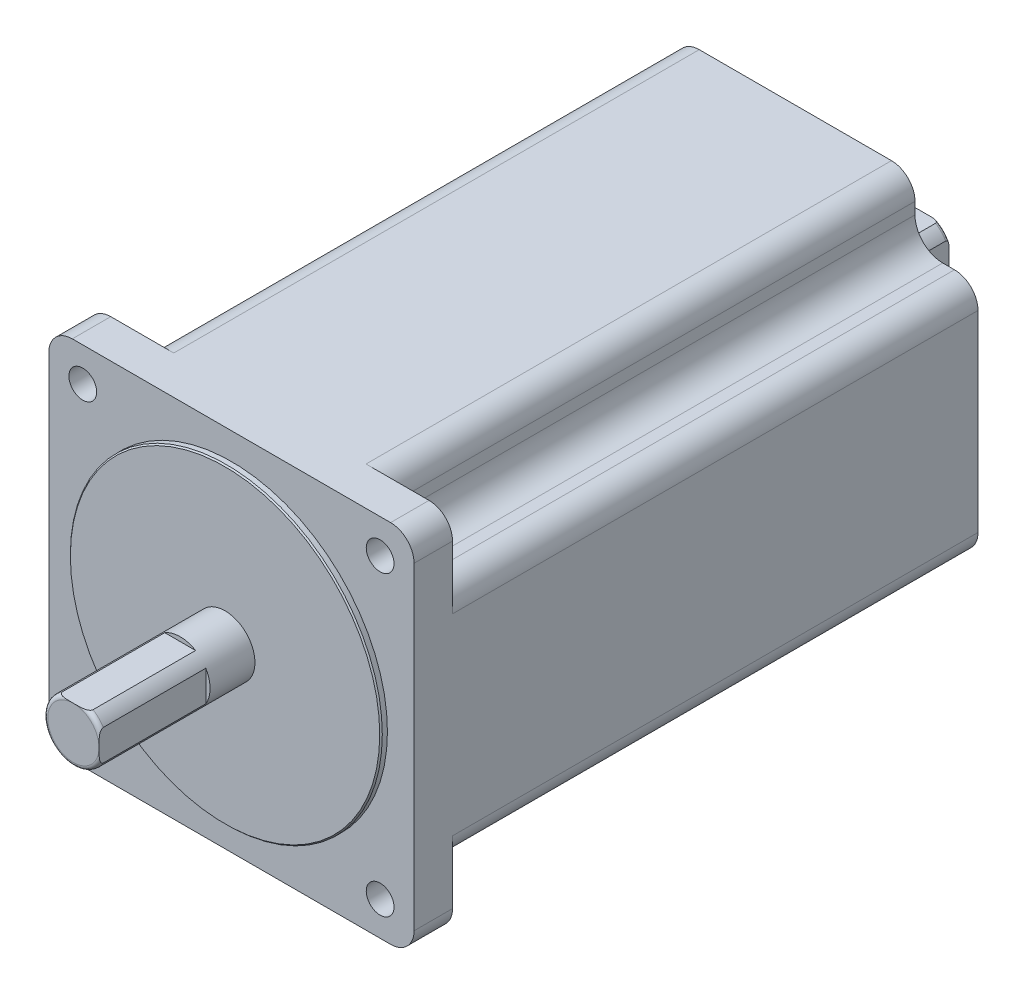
SolidWorks part; units mm, degrees
ref_plane "正面" through (0, 0, 0) normal (0, 0, 1) x (1, 0, 0)
ref_plane "平面" through (0, 0, 0) normal (0, 1, 0) x (1, 0, 0)
ref_plane "右側面" through (0, 0, 0) normal (1, 0, 0) x (0, 0, -1)
sketch "ｽｹｯﾁ1" plane through (0, 0, 0) normal (0, 0, 1) x (1, 0, 0)
  circle A0 centre (0, 0) radius 7
  dimension "D1" = 14
extrude "押し出し1" add sketch "ｽｹｯﾁ1" along normal blind 35.5
sketch "ｽｹｯﾁ2" plane through (0, 0, 0) normal (0, 0, -1) x (-1, 0, 0)
  circle A0 centre (0, 0) radius 36.5125
  dimension "D1" = 73.025
extrude "押し出し2" add sketch "ｽｹｯﾁ2" along normal blind 1.5
sketch "ｽｹｯﾁ3" plane through (0, 0, -1.5) normal (0, 0, -1) x (-1, 0, 0)
  line L1 (-42.75, 42.75) -> (42.75, 42.75)
  line L2 (-42.75, 42.75) -> (-42.75, -42.75)
  line L3 (-42.75, -42.75) -> (42.75, -42.75)
  line L4 (42.75, 42.75) -> (42.75, -42.75)
  line L5 (-42.75, 42.75) -> (42.75, -42.75) construction
  line L6 (-42.75, -42.75) -> (42.75, 42.75) construction
  line L7 (34.8, 34.8) -> (-34.8, 34.8) construction
  line L8 (34.8, 34.8) -> (34.8, -34.8) construction
  line L9 (34.8, -34.8) -> (-34.8, -34.8) construction
  line L10 (-34.8, 34.8) -> (-34.8, -34.8) construction
  line L11 (34.8, 34.8) -> (-34.8, -34.8) construction
  line L12 (34.8, -34.8) -> (-34.8, 34.8) construction
  circle A0 centre (34.8, 34.8) radius 3.25
  circle A1 centre (-34.8, 34.8) radius 3.25
  circle A2 centre (34.8, -34.8) radius 3.25
  circle A3 centre (-34.8, -34.8) radius 3.25
  point P0 (0, 0)
  point P6 (0, 0)
  dimension "D3" = 69.6
  dimension "D4" = 69.6
  dimension "D6" = 6.5
  dimension "D1" = 85.5
  dimension "D2" = 85.5
extrude "押し出し3" add sketch "ｽｹｯﾁ3" along normal blind 9
fillet "Fillet1" radius 5.5 4 edges at (42.75, -42.75, -6) (-42.75, -42.75, -6) (-42.75, 42.75, -6) (42.75, 42.75, -6)
sketch "ｽｹｯﾁ4" plane through (0, 0, -10.5) normal (0, 0, -1) x (-1, 0, 0)
  line L0 (28, 28) -> (42.75, 28)
  line L1 (-28, 42.75) -> (28, 42.75)
  line L2 (-28, 42.75) -> (-28, 28)
  line L3 (-28, -42.75) -> (28, -42.75)
  line L4 (28, 42.75) -> (28, 28)
  line L5 (-28, 42.75) -> (28, -42.75) construction
  line L6 (-28, -42.75) -> (28, 42.75) construction
  line L7 (-42.75, 28) -> (-28, 28)
  line L8 (-42.75, 28) -> (-42.75, -28)
  line L9 (-42.75, -28) -> (-28, -28)
  line L10 (42.75, 28) -> (42.75, -28)
  line L11 (-42.75, 28) -> (42.75, -28) construction
  line L12 (-42.75, -28) -> (42.75, 28) construction
  line L13 (-28, -28) -> (-28, -42.75)
  line L14 (28, -28) -> (42.75, -28)
  line L15 (28, -28) -> (28, -42.75)
  point P0 (0, 0)
  point P6 (0, 0)
  dimension "D1" = 56
  dimension "D2" = 85.5
  dimension "D3" = 85.5
  dimension "D4" = 56
extrude "押し出し4" add sketch "ｽｹｯﾁ4" along normal blind 123
fillet "Fillet2" radius 6.5 4 edges at (28, -28, -72) (-28, -28, -72) (-28, 28, -72) (28, 28, -72)
fillet "Fillet3" radius 5.5 8 edges
sketch "Sketch1" plane through (0, -42.75, 0) normal (0, -1, 0) x (1, 0, 0)
  line L0 (22.5, -133.5) -> (-22.5, -133.5) construction
  line L1 (-13.25, -133.5) -> (13.25, -133.5)
  line L2 (-13.25, -133.5) -> (-13.25, -112.5)
  line L3 (-13.25, -112.5) -> (13.25, -112.5)
  line L4 (13.25, -133.5) -> (13.25, -112.5)
  dimension "D1" = 21
  dimension "D2" = 26.5
  dimension "D3" = 13.25
extrude "Extrude1" add sketch "Sketch1" along normal blind 12
sketch "Sketch5" plane through (13.25, 0, 0) normal (1, 0, 0) x (0, 0, -1)
  line L0 (133.5, -47.75) -> (124.9, -54.75)
  line L3 (133.5, -54.75) -> (133.5, -42.75) construction
  line L4 (133.5, -54.75) -> (112.5, -54.75) construction
  line L6 (124.9, -54.75) -> (133.5, -54.75)
  line L8 (133.5, -54.75) -> (133.5, -47.75)
  dimension "D1" = 7
  dimension "D2" = 8.6
extrude "Extrude4" cut sketch "Sketch5" against normal through all and the other way through all
sketch "Sketch6" plane through (0, 0, -112.5) normal (0, 0, 1) x (1, 0, 0)
  line L0 (-13.25, -49.75) -> (-13.25, -54.75)
  line L2 (-13.25, -49.75) -> (-13.25, -54.75)
  line L3 (-13.25, -54.75) -> (-7.5, -54.75)
  line L4 (13.25, -54.75) -> (-13.25, -54.75) construction
  line L5 (-7.5, -54.75) -> (-13.25, -49.75)
  line L6 (13.25, -49.75) -> (13.25, -54.75)
  line L7 (13.25, -54.75) -> (13.25, -42.75) construction
  line L8 (13.25, -54.75) -> (7.5, -54.75)
  line L9 (7.5, -54.75) -> (13.25, -49.75)
  dimension "D1" = 5
  dimension "D2" = 7.5
  dimension "D3" = 15
  dimension "D4" = 5
extrude "Extrude5" cut sketch "Sketch6" against normal through all contours L5 M3 M2 | L9 M3 M4
fillet "Fillet4" radius 1 1 edges at (7, 0, 35.5)
sketch "Sketch2" plane through (0, 0, 35.5) normal (0, 0, 1) x (1, 0, 0)
  line L1 (-7, 8) -> (7, 8)
  line L2 (-7, 8) -> (-7, 6)
  line L3 (-7, 6) -> (7, 6)
  line L4 (7, 8) -> (7, 6)
  line L5 (8, -8) -> (6, -8)
  line L6 (8, -8) -> (8, 6)
  line L7 (8, 6) -> (6, 6)
  line L8 (6, -8) -> (6, 6)
  circle A0 centre (0, 0) radius 7 construction
  dimension "D1" = 6
  dimension "D2" = 14
  dimension "D3" = 2
  dimension "D4" = 7
  dimension "D5" = 6
  dimension "D6" = 2
  dimension "D7" = 14
extrude "Extrude2" cut sketch "Sketch2" against normal blind 25 contours L4 L1 L2 L3 | L6 L7 L8 L5
chamfer "Chamfer2" distance 0.3 angle 45 1 edges at (-36.5125, 0, 0)
sketch "Sketch3" plane through (0, 0, -1.5) normal (0, 0, 1) x (1, 0, 0)
  circle A0 centre (0, 0) radius 18
  circle A1 centre (0, 0) radius 24.35
  dimension "D1" = 48.7
  dimension "D2" = 36
extrude "Extrude3" cut sketch "Sketch3" against normal blind 0.2
chamfer "Chamfer3" distance 0.2 distance2 0.4 1 edges at (24.35, 0, -1.7)
sketch "Sketch7" plane through (0, 0, -133.5) normal (0, 0, -1) x (-1, 0, 0)
  circle A0 centre (0, 0) radius 7
  dimension "D1" = 14
extrude "Extrude6" add sketch "Sketch7" along normal blind 30
fillet "Fillet5" radius 0.8 1 edges at (-7, 0, -163.5)
sketch "Sketch8" plane through (0, 0, -163.5) normal (0, 0, -1) x (-1, 0, 0)
  line L1 (-7, 8) -> (7, 8)
  line L2 (-7, 8) -> (-7, 6)
  line L3 (-7, 6) -> (7, 6)
  line L4 (7, 8) -> (7, 6)
  line L5 (-7, 8) -> (7, 6) construction
  line L6 (-7, 6) -> (7, 8) construction
  line L7 (-6, 7) -> (-8, 7)
  line L8 (-6, 7) -> (-6, -7)
  line L9 (-6, -7) -> (-8, -7)
  line L10 (-8, 7) -> (-8, -7)
  line L11 (-6, 7) -> (-8, -7) construction
  line L12 (-6, -7) -> (-8, 7) construction
  point P0 (0, 7)
  point P6 (-7, 0)
  dimension "D1" = 6
  dimension "D2" = 7
  dimension "D3" = 14
  dimension "D4" = 2
  dimension "D5" = 6
  dimension "D6" = 7
  dimension "D7" = 14
  dimension "D8" = 2
extrude "Extrude7" cut sketch "Sketch8" against normal blind 25 contours L8 L7 L4 L1 L2 L3 M1 | L3 M1 | L7 L10 L9 L8 L3 L2 M1 | L8 M1
